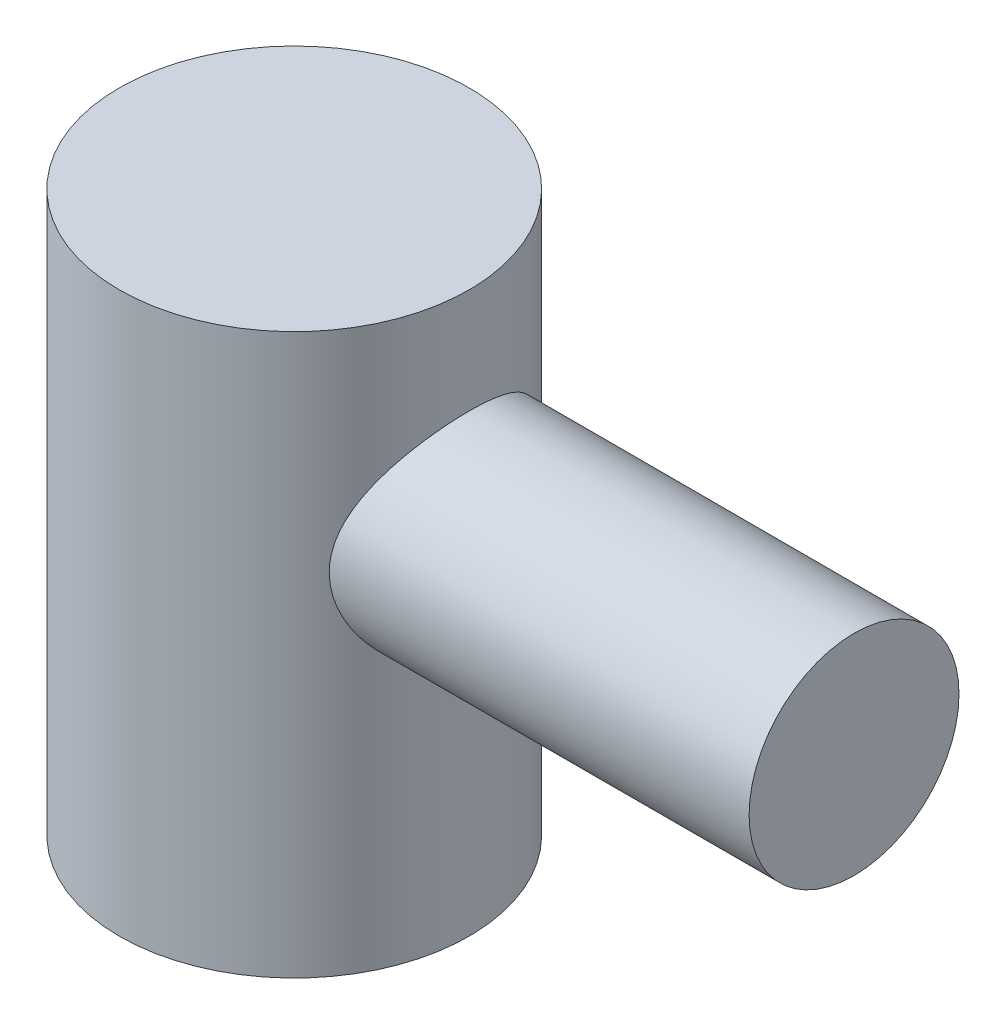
SolidWorks part; units mm, degrees
ref_plane "Alzado" through (0, 0, 0) normal (0, 0, 1) x (1, 0, 0)
ref_plane "Planta" through (0, 0, 0) normal (0, 1, 0) x (1, 0, 0)
ref_plane "Vista lateral" through (0, 0, 0) normal (1, 0, 0) x (0, 0, -1)
sketch "Croquis1" plane through (0, 0, 0) normal (0, 1, 0) x (1, 0, 0)
  circle A0 centre (0, 0) radius 25
  dimension "D1" = 50
extrude "Saliente-Extruir1" add sketch "Croquis1" along normal blind 80
sketch "Croquis2" plane through (0, 0, 0) normal (1, 0, 0) x (0, 0, -1)
  line L0 (-25, 0) -> (25, 0) construction
  circle A0 centre (0, 50) radius 15
  dimension "D1" = 50
  dimension "D2" = 30
extrude "Saliente-Extruir2" add sketch "Croquis2" along normal blind 80
